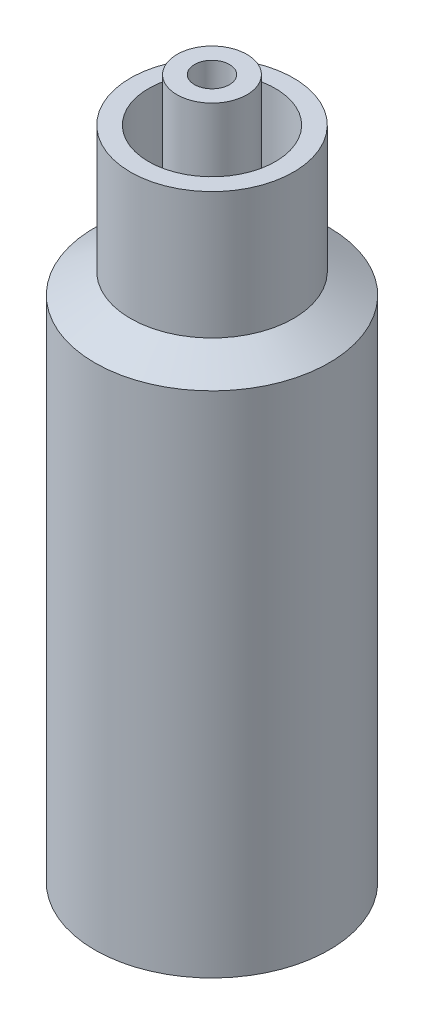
SolidWorks part; units mm, degrees
ref_plane "Front Plane" through (0, 0, 0) normal (0, 0, 1) x (1, 0, 0)
ref_plane "Top Plane" through (0, 0, 0) normal (0, 1, 0) x (1, 0, 0)
ref_plane "Right Plane" through (0, 0, 0) normal (1, 0, 0) x (0, 0, -1)
sketch "Sketch1" plane through (0, 0, 0) normal (0, 0, 1) x (1, 0, 0)
  line L0 (0, 0) -> (0, -74.4589) construction
  line L1 (-5.7912, 0) -> (-6.8072, 0)
  line L2 (-6.8072, 0) -> (-6.8072, 29.5388)
  line L3 (-3.683, 31.3426) -> (-2.032, 32.2958)
  line L4 (-4.7371, 30.734) -> (-4.7371, 38.1)
  line L5 (-4.7371, 38.1) -> (-3.683, 38.1)
  line L6 (-3.683, 38.1) -> (-3.683, 31.3426)
  line L8 (-2.032, 32.2958) -> (-2.032, 40.64)
  line L9 (-2.032, 40.64) -> (-1.016, 40.64)
  line L10 (-4.7371, 30.734) -> (-6.8072, 29.5388)
  line L11 (-5.7912, 0) -> (-5.7912, 28.9522)
  line L12 (-5.7912, 28.9522) -> (-1.016, 31.7092)
  line L13 (-1.016, 31.7092) -> (-1.016, 40.64)
  dimension "D1" = 13.6144
  dimension "D2" = 9.4742
  dimension "D3" = 7.366
  dimension "D4" = 2.54
  dimension "D5" = 4.064
  dimension "D6" = 7.366
  dimension "D7" = 38.1
  dimension "D8" = 1.016
  dimension "D9" = 120
  dimension "D11" = 1.016
  dimension "D12" = 1.016
revolve "Revolve1" add sketch "Sketch1" angle 360 about L0
sketch "Sketch2" plane through (0, 0, 0) normal (0, 0, 1) x (1, 0, 0)
  line L0 (0, 12.2401) -> (-5.715, 10.16)
  line L1 (-5.715, 10.16) -> (-5.715, 6.35)
  line L2 (-5.715, 6.35) -> (0, 6.35)
  line L3 (0, 6.35) -> (0, 12.2401)
  line L4 (0, 0) -> (0, 12.2401) construction
  dimension "D1" = 11.43
  dimension "D2" = 70
  dimension "D3" = 3.81
  dimension "D4" = 6.35
revolve "Revolve2" add sketch "Sketch2" angle 360 about L4
